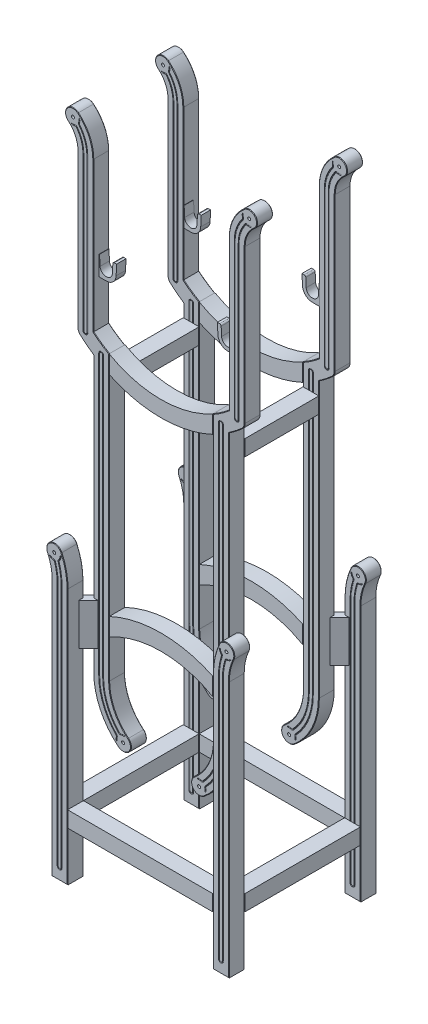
SolidWorks part; units mm, degrees
ref_plane "Спереди" through (0, 0, 0) normal (0, 0, 1) x (1, 0, 0)
ref_plane "Сверху" through (0, 0, 0) normal (0, 1, 0) x (1, 0, 0)
ref_plane "Справа" through (0, 0, 0) normal (1, 0, 0) x (0, 0, -1)
sketch "Эскиз1" plane through (0, 0, 0) normal (0, 0, 1) x (1, 0, 0)
  line L0 (0, 1637.8795) -> (0, -58.0096) construction
  line L1 (-137, 1254.605) -> (-137, 952.3834)
  line L2 (-169, 1254.605) -> (-169, 945.0706)
  line L3 (-223, 1254.605) -> (-137, 1254.605) construction
  line L4 (-223, 1324.28) -> (-137, 1324.28) construction
  line L5 (-318.8332, 902.64) -> (342.8075, 902.64) construction
  line L6 (-137, 912.4153) -> (-137, 357)
  line L7 (-105, 930.2397) -> (-105, 357)
  line L8 (-60.855, 312.7131) -> (-60.855, 178.9161) construction
  line L9 (137, 1254.605) -> (137, 952.3834)
  line L10 (169, 1254.605) -> (169, 945.0706)
  line L11 (137, 912.4153) -> (137, 357)
  line L12 (105, 930.2397) -> (105, 357)
  arc A0 (-137, 1254.605) -> (-167.7963, 1320.5486) centre (-223, 1254.605) ccw
  arc A1 (-169, 1254.605) -> (-188.3372, 1296.0114) centre (-223, 1254.605) ccw
  arc A2 (-167.7963, 1320.5486) -> (-188.3372, 1296.0114) centre (-178.0668, 1308.28) ccw
  circle A3 centre (-223, 1254.605) radius 86 construction
  circle A4 centre (-223, 1254.605) radius 54 construction
  arc A5 (-137, 952.3834) -> (-105, 930.2397) centre (0, 1116.17) ccw
  arc A6 (-163.6653, 933.1436) -> (-137, 912.4153) centre (0, 1116.17) ccw
  arc A7 (-157.5311, 927.838) -> (0, 870.64) centre (0, 1116.17) ccw construction
  arc A8 (-137, 952.3834) -> (0, 902.64) centre (0, 1116.17) ccw construction
  arc A9 (-163.6653, 933.1436) -> (-169, 945.0706) centre (-153, 945.0706) cw
  arc A10 (-105, 357) -> (-66.6924, 275.9005) centre (0, 357) ccw
  arc A11 (-137, 357) -> (-87.0176, 251.1845) centre (0, 357) ccw
  circle A12 centre (0, 357) radius 137 construction
  circle A13 centre (0, 357) radius 105 construction
  arc A14 (-87.0176, 251.1845) -> (-66.6924, 275.9005) centre (-76.855, 263.5425) ccw
  arc A15 (137, 1254.605) -> (167.7963, 1320.5486) centre (223, 1254.605) cw
  arc A16 (167.7963, 1320.5486) -> (188.3372, 1296.0114) centre (178.0668, 1308.28) cw
  arc A17 (169, 1254.605) -> (188.3372, 1296.0114) centre (223, 1254.605) cw
  arc A18 (163.6653, 933.1436) -> (169, 945.0706) centre (153, 945.0706) ccw
  arc A19 (137, 952.3834) -> (105, 930.2397) centre (0, 1116.17) cw
  arc A20 (163.6653, 933.1436) -> (137, 912.4153) centre (0, 1116.17) cw
  arc A21 (105, 357) -> (66.6924, 275.9005) centre (0, 357) cw
  arc A22 (137, 357) -> (87.0176, 251.1845) centre (0, 357) cw
  arc A23 (87.0176, 251.1845) -> (66.6924, 275.9005) centre (76.855, 263.5425) cw
  dimension "D3" = 172
  dimension "D6" = 32
  dimension "D9" = 427.06
  dimension "D13" = 16
  dimension "D14" = 210
  dimension "D1" = 32
  dimension "D2" = 169
  dimension "D5" = 69.675
  dimension "D7" = 1324.28
  dimension "D8" = 421.64
  dimension "D11" = 32
  dimension "D12" = 137
  dimension "D15" = 357
  dimension "D17" = 60.855
  dimension "D4" = 32
  dimension "D10" = 32
  dimension "D16" = 32
extrude "Бобышка-Вытянуть1" add sketch "Эскиз1" along normal blind 32
sketch "Эскиз2" plane through (0, 0, 0) normal (0, 0, 1) x (1, 0, 0)
  line L0 (0, 1637.8795) -> (0, -58.0096) construction
  line L1 (-105, 930.2397) -> (-105, 357) construction
  line L2 (-105, 930.2397) -> (-105, 894.2241)
  line L3 (105, 930.2397) -> (105, 894.2241)
  line L4 (-232.7595, 494) -> (202.7807, 494) construction
  line L5 (-232.7595, 870.64) -> (202.7807, 870.64) construction
  line L6 (-105, 470.4159) -> (-105, 434.4003)
  line L7 (105, 470.4159) -> (105, 434.4003)
  line L8 (-53.704, 417) -> (42.7851, 417) construction
  arc A0 (-137, 952.3834) -> (-105, 930.2397) centre (0, 1116.17) ccw construction
  arc A1 (-105, 930.2397) -> (105, 930.2397) centre (0, 1116.17) ccw
  arc A2 (-163.6653, 933.1436) -> (-137, 912.4153) centre (0, 1116.17) ccw construction
  arc A3 (-105, 894.2241) -> (105, 894.2241) centre (0, 1116.17) ccw
  arc A4 (105, 470.4159) -> (-105, 470.4159) centre (0, 248.47) ccw
  arc A5 (105, 434.4003) -> (-105, 434.4003) centre (0, 248.47) ccw
  circle A6 centre (0, 248.47) radius 245.53 construction
  circle A7 centre (0, 248.47) radius 213.53 construction
  circle A8 centre (0, 357) radius 60 construction
  arc A9 (-105, 357) -> (-66.6924, 275.9005) centre (0, 357) ccw construction
  dimension "D1" = 213.53
  dimension "D4" = 120
  dimension "D2" = 77
  dimension "D3" = 32
extrude "Бобышка-Вытянуть2" add sketch "Эскиз2" along normal blind 32 separate body
ref_plane "Плоскость1" through (0, 0, -150) normal (0, 0, 1) x (1, 0, 0)
sketch "Эскиз3" plane through (0, 0, -150) normal (0, 0, 1) x (1, 0, 0)
  line L0 (-169, 1254.605) -> (-169, 945.0706) construction
  line L1 (-137, 1254.605) -> (-137, 952.3834) construction
  line L2 (-105, 930.2397) -> (-105, 357) construction
  line L3 (-137, 912.4153) -> (-137, 357) construction
  line L4 (105, 930.2397) -> (105, 357) construction
  line L5 (137, 912.4153) -> (137, 357) construction
  line L6 (169, 1254.605) -> (169, 945.0706) construction
  line L7 (137, 1254.605) -> (137, 952.3834) construction
  line L8 (-169, 1254.605) -> (-169, 945.0706)
  line L9 (-137, 1254.605) -> (-137, 952.3834)
  line L10 (-105, 930.2397) -> (-105, 357)
  line L11 (-137, 912.4153) -> (-137, 357)
  line L12 (105, 930.2397) -> (105, 357)
  line L13 (137, 912.4153) -> (137, 357)
  line L14 (169, 1254.605) -> (169, 945.0706)
  line L15 (137, 1254.605) -> (137, 952.3834)
  arc A0 (-167.7963, 1320.5486) -> (-188.3372, 1296.0114) centre (-178.0668, 1308.28) ccw construction
  arc A1 (-169, 1254.605) -> (-188.3372, 1296.0114) centre (-223, 1254.605) ccw construction
  arc A2 (-137, 1254.605) -> (-167.7963, 1320.5486) centre (-223, 1254.605) ccw construction
  arc A3 (-163.6653, 933.1436) -> (-137, 912.4153) centre (0, 1116.17) ccw construction
  arc A4 (-169, 945.0706) -> (-163.6653, 933.1436) centre (-153, 945.0706) ccw construction
  arc A5 (-137, 952.3834) -> (-105, 930.2397) centre (0, 1116.17) ccw construction
  arc A6 (-137, 357) -> (-87.0176, 251.1845) centre (0, 357) ccw construction
  arc A7 (-105, 357) -> (-66.6924, 275.9005) centre (0, 357) ccw construction
  arc A8 (-87.0176, 251.1845) -> (-66.6924, 275.9005) centre (-76.855, 263.5425) ccw construction
  arc A9 (66.6924, 275.9005) -> (87.0176, 251.1845) centre (76.855, 263.5425) ccw construction
  arc A10 (66.6924, 275.9005) -> (105, 357) centre (0, 357) ccw construction
  arc A11 (87.0176, 251.1845) -> (137, 357) centre (0, 357) ccw construction
  arc A12 (105, 930.2397) -> (137, 952.3834) centre (0, 1116.17) ccw construction
  arc A13 (137, 912.4153) -> (163.6653, 933.1436) centre (0, 1116.17) ccw construction
  arc A14 (163.6653, 933.1436) -> (169, 945.0706) centre (153, 945.0706) ccw construction
  arc A15 (167.7963, 1320.5486) -> (137, 1254.605) centre (223, 1254.605) ccw construction
  arc A16 (188.3372, 1296.0114) -> (169, 1254.605) centre (223, 1254.605) ccw construction
  arc A17 (188.3372, 1296.0114) -> (167.7963, 1320.5486) centre (178.0668, 1308.28) ccw construction
  arc A18 (-167.7963, 1320.5486) -> (-188.3372, 1296.0114) centre (-178.0668, 1308.28) ccw
  arc A19 (-169, 1254.605) -> (-188.3372, 1296.0114) centre (-223, 1254.605) ccw
  arc A20 (-137, 1254.605) -> (-167.7963, 1320.5486) centre (-223, 1254.605) ccw
  arc A21 (-163.6653, 933.1436) -> (-137, 912.4153) centre (0, 1116.17) ccw
  arc A22 (-169, 945.0706) -> (-163.6653, 933.1436) centre (-153, 945.0706) ccw
  arc A23 (-137, 952.3834) -> (-105, 930.2397) centre (0, 1116.17) ccw
  arc A24 (-137, 357) -> (-87.0176, 251.1845) centre (0, 357) ccw
  arc A25 (-105, 357) -> (-66.6924, 275.9005) centre (0, 357) ccw
  arc A26 (-87.0176, 251.1845) -> (-66.6924, 275.9005) centre (-76.855, 263.5425) ccw
  arc A27 (66.6924, 275.9005) -> (87.0176, 251.1845) centre (76.855, 263.5425) ccw
  arc A28 (66.6924, 275.9005) -> (105, 357) centre (0, 357) ccw
  arc A29 (87.0176, 251.1845) -> (137, 357) centre (0, 357) ccw
  arc A30 (105, 930.2397) -> (137, 952.3834) centre (0, 1116.17) ccw
  arc A31 (137, 912.4153) -> (163.6653, 933.1436) centre (0, 1116.17) ccw
  arc A32 (163.6653, 933.1436) -> (169, 945.0706) centre (153, 945.0706) ccw
  arc A33 (167.7963, 1320.5486) -> (137, 1254.605) centre (223, 1254.605) ccw
  arc A34 (188.3372, 1296.0114) -> (169, 1254.605) centre (223, 1254.605) ccw
  arc A35 (188.3372, 1296.0114) -> (167.7963, 1320.5486) centre (178.0668, 1308.28) ccw
extrude "Бобышка-Вытянуть3" add sketch "Эскиз3" against normal blind 32 separate body
sketch "Эскиз4" plane through (0, 0, -150) normal (0, 0, 1) x (1, 0, 0)
  line L0 (-105, 930.2397) -> (-105, 894.2241) construction
  line L1 (105, 930.2397) -> (105, 894.2241) construction
  line L2 (-105, 470.4159) -> (-105, 434.4003) construction
  line L3 (105, 470.4159) -> (105, 434.4003) construction
  line L4 (-105, 930.2397) -> (-105, 894.2241)
  line L5 (105, 930.2397) -> (105, 894.2241)
  line L6 (-105, 470.4159) -> (-105, 434.4003)
  line L7 (105, 470.4159) -> (105, 434.4003)
  arc A0 (-105, 930.2397) -> (105, 930.2397) centre (0, 1116.17) ccw construction
  arc A1 (-105, 894.2241) -> (105, 894.2241) centre (0, 1116.17) ccw construction
  arc A2 (105, 434.4003) -> (-105, 434.4003) centre (0, 248.47) ccw construction
  arc A3 (105, 470.4159) -> (-105, 470.4159) centre (0, 248.47) ccw construction
  arc A4 (-105, 930.2397) -> (105, 930.2397) centre (0, 1116.17) ccw
  arc A5 (-105, 894.2241) -> (105, 894.2241) centre (0, 1116.17) ccw
  arc A6 (105, 434.4003) -> (-105, 434.4003) centre (0, 248.47) ccw
  arc A7 (105, 470.4159) -> (-105, 470.4159) centre (0, 248.47) ccw
extrude "Бобышка-Вытянуть4" add sketch "Эскиз4" against normal blind 32 separate body
sketch "Эскиз5" plane through (137, 0, 0) normal (1, 0, 0) x (0, 0, -1)
  line L0 (0, 886.555) -> (150, 886.555)
  line L1 (0, 357) -> (0, 912.4153) construction
  line L2 (150, 357) -> (150, 912.4153) construction
  line L3 (0, 854.555) -> (150, 854.555)
  line L5 (0, 1324.28) -> (-32, 1324.28) construction
  line L6 (0, 886.555) -> (0, 854.555)
  line L7 (150, 886.555) -> (150, 854.555)
  dimension "D1" = 32
  dimension "D2" = 437.725
extrude "Бобышка-Вытянуть5" add sketch "Эскиз5" against normal blind 32 separate body
sketch "Эскиз6" plane through (-137, 0, 0) normal (-1, 0, 0) x (0, 0, 1)
  line L0 (-150, 886.555) -> (0, 886.555) construction
  line L1 (0, 854.555) -> (-150, 854.555) construction
  line L2 (-150, 886.555) -> (0, 886.555)
  line L3 (0, 854.555) -> (-150, 854.555)
  line L4 (0, 912.4153) -> (0, 357)
  line L5 (0, 357) -> (32, 357)
  line L6 (32, 357) -> (32, 912.4153)
  line L7 (32, 912.4153) -> (0, 912.4153)
  line L8 (0, 912.4153) -> (0, 357)
  line L9 (0, 357) -> (32, 357)
  line L10 (32, 357) -> (32, 912.4153)
  line L11 (32, 912.4153) -> (0, 912.4153)
  line L12 (-150, 886.555) -> (-150, 854.555)
  line L13 (0, 886.555) -> (0, 854.555)
  dimension "D1" = 0
extrude "Бобышка-Вытянуть6" add sketch "Эскиз6" against normal blind 32 separate body contours L3 L12 L2 L13
chamfer "Фаска1" distance 1 angle 45 13 edges at (-121.5055, 940.5811, 32) (-137, 1103.4942, 32) (-145.0785, 1290.9951, 32) (-105, 643.6199, 32) (-190.3354, 1318.5505, 32) (-94.9413, 312.1541, 32) (-174.0726, 1277.4546, 32) (-64.497, 253.3798, 32) (-169, 1099.8378, 32) (-123.8758, 298.4868, 32) (-167.6056, 938.5377, 32) (-137, 634.7076, 32) (-150.6895, 922.3204, 32)
chamfer "Фаска2" distance 1 angle 45 13 edges at (137, 1103.4942, 32) (145.0785, 1290.9951, 32) (190.3354, 1318.5505, 32) (174.0726, 1277.4546, 32) (169, 1099.8378, 32) (167.6056, 938.5377, 32) (150.6895, 922.3204, 32) (121.5055, 940.5811, 32) (105, 643.6199, 32) (94.9413, 312.1541, 32) (64.497, 253.3798, 32) (137, 634.7076, 32) (123.8758, 298.4868, 32)
chamfer "Фаска3" distance 1 angle 45 4 edges at (105, 912.2319, 32) (-105, 912.2319, 32) (105, 912.2319, 0) (-105, 912.2319, 0)
chamfer "Фаска4" distance 1 angle 45 2 edges at (105, 452.4081, 32) (-105, 452.4081, 32)
chamfer "Фаска5" distance 1 angle 45 13 edges at (137, 1103.4942, 0) (145.0785, 1290.9951, 0) (190.3354, 1318.5505, 0) (174.0726, 1277.4546, 0) (169, 1099.8378, 0) (167.6056, 938.5377, 0) (150.6895, 922.3204, 0) (121.5055, 940.5811, 0) (137, 634.7076, 0) (123.8758, 298.4868, 0) (105, 643.6199, 0) (64.497, 253.3798, 0) (94.9413, 312.1541, 0)
chamfer "Фаска6" distance 1 angle 45 13 edges at (-137, 1103.4942, 0) (-145.0785, 1290.9951, 0) (-190.3354, 1318.5505, 0) (-174.0726, 1277.4546, 0) (-169, 1099.8378, 0) (-167.6056, 938.5377, 0) (-150.6895, 922.3204, 0) (-121.5055, 940.5811, 0) (-137, 634.7076, 0) (-123.8758, 298.4868, 0) (-64.497, 253.3798, 0) (-105, 643.6199, 0) (-94.9413, 312.1541, 0)
chamfer "Фаска7" distance 1 angle 45 2 edges at (-105, 452.4081, 0) (105, 452.4081, 0)
chamfer "Фаска8" distance 1 angle 45 13 edges at (-137, 1103.4942, -150) (-145.0785, 1290.9951, -150) (-190.3354, 1318.5505, -150) (-174.0726, 1277.4546, -150) (-169, 1099.8378, -150) (-167.6056, 938.5377, -150) (-150.6895, 922.3204, -150) (-137, 634.7076, -150) (-123.8758, 298.4868, -150) (-64.497, 253.3798, -150) (-94.9413, 312.1541, -150) (-121.5055, 940.5811, -150) (-105, 643.6199, -150)
chamfer "Фаска9" distance 1 angle 45 13 edges at (150.6895, 922.3204, -150) (167.6056, 938.5377, -150) (137, 634.7076, -150) (169, 1099.8378, -150) (123.8758, 298.4868, -150) (174.0726, 1277.4546, -150) (64.497, 253.3798, -150) (190.3354, 1318.5505, -150) (94.9413, 312.1541, -150) (145.0785, 1290.9951, -150) (105, 643.6199, -150) (121.5055, 940.5811, -150) (137, 1103.4942, -150)
chamfer "Фаска10" distance 1 angle 45 2 edges at (105, 452.4081, -150) (-105, 452.4081, -150)
chamfer "Фаска11" distance 1 angle 45 13 edges at (105, 643.6199, -182) (94.9413, 312.1541, -182) (64.497, 253.3798, -182) (123.8758, 298.4868, -182) (137, 634.7076, -182) (150.6895, 922.3204, -182) (167.6056, 938.5377, -182) (169, 1099.8378, -182) (174.0726, 1277.4546, -182) (190.3354, 1318.5505, -182) (145.0785, 1290.9951, -182) (137, 1103.4942, -182) (121.5055, 940.5811, -182)
chamfer "Фаска12" distance 1 angle 45 13 edges at (-137, 1103.4942, -182) (-145.0785, 1290.9951, -182) (-190.3354, 1318.5505, -182) (-174.0726, 1277.4546, -182) (-169, 1099.8378, -182) (-167.6056, 938.5377, -182) (-150.6895, 922.3204, -182) (-137, 634.7076, -182) (-123.8758, 298.4868, -182) (-64.497, 253.3798, -182) (-94.9413, 312.1541, -182) (-121.5055, 940.5811, -182) (-105, 643.6199, -182)
chamfer "Фаска13" distance 1 angle 45 4 edges at (-105, 912.2319, -182) (105, 912.2319, -182) (-105, 912.2319, -150) (105, 912.2319, -150)
chamfer "Фаска14" distance 1 angle 45 2 edges at (-105, 452.4081, -182) (105, 452.4081, -182)
chamfer "Фаска15" distance 1 angle 45 4 edges at (105, 870.555, 0) (105, 870.555, -150) (137, 870.555, -150) (137, 870.555, 0)
chamfer "Фаска16" distance 1 angle 45 4 edges at (-105, 870.555, 0) (-105, 870.555, -150) (-137, 870.555, 0) (-137, 870.555, -150)
ref_plane "Плоскость2" through (0, 0, 1) normal (0, 0, 1) x (1, 0, 0)
sketch "Эскиз7" plane through (0, 0, 1) normal (0, 0, 1) x (1, 0, 0)
  line L0 (0, 1411.9456) -> (0, 0) construction
  line L1 (122.85, 1062.87) -> (0, 1062.87) construction
  line L2 (0, 1062.87) -> (-122.85, 1062.87) construction
  line L3 (-137, 1042.87) -> (-122.85, 1042.87)
  line L4 (-137, 1254.605) -> (-137, 952.3834) construction
  line L5 (-109.4965, 1080.0165) -> (-110.3649, 1062.2594)
  line L6 (-122.85, 1062.87) -> (-122.85, 1042.87) construction
  line L7 (-101.8479, 1082.87) -> (-102.8739, 1061.893)
  line L8 (-106.5, 1082.87) -> (-101.8479, 1082.87)
  line L9 (-136.3431, 1082.87) -> (-135.3351, 1062.2594)
  line L10 (-136.3431, 1082.87) -> (-137, 1082.87)
  line L11 (-137, 1082.87) -> (-137, 1042.87)
  line L12 (136.3431, 1082.87) -> (137, 1082.87)
  line L13 (136.3431, 1082.87) -> (135.3351, 1062.2594)
  line L14 (137, 1082.87) -> (137, 1042.87)
  line L15 (137, 1042.87) -> (122.85, 1042.87)
  line L16 (109.4965, 1080.0165) -> (110.3649, 1062.2594)
  line L17 (101.8479, 1082.87) -> (102.8739, 1061.893)
  line L18 (106.5, 1082.87) -> (101.8479, 1082.87)
  arc A0 (-135.3351, 1062.2594) -> (-110.3649, 1062.2594) centre (-122.85, 1062.87) ccw
  arc A1 (110.3649, 1062.2594) -> (135.3351, 1062.2594) centre (122.85, 1062.87) ccw
  arc A2 (-122.85, 1042.87) -> (-102.8739, 1061.893) centre (-122.85, 1062.87) ccw
  arc A3 (-106.5, 1082.87) -> (-109.4965, 1080.0165) centre (-106.5, 1079.87) ccw
  arc A4 (122.85, 1042.87) -> (102.8739, 1061.893) centre (122.85, 1062.87) cw
  arc A5 (106.5, 1082.87) -> (109.4965, 1080.0165) centre (106.5, 1079.87) cw
  point P20 (-109.3569, 1082.87)
  dimension "D1" = 25
  dimension "D7" = 3
  dimension "D2" = 1062.87
  dimension "D3" = 245.7
  dimension "D4" = 20
  dimension "D5" = 2.8
  dimension "D6" = 20
extrude "Бобышка-Вытянуть7" add sketch "Эскиз7" along normal blind 19 separate body
ref_plane "Плоскость3" through (0, 0, -151) normal (0, 0, 1) x (1, 0, 0)
sketch "Эскиз8" plane through (0, 0, -151) normal (0, 0, 1) x (1, 0, 0)
  line L0 (-135.3351, 1062.2594) -> (-136.3431, 1082.87) construction
  line L1 (-109.4965, 1080.0165) -> (-110.3649, 1062.2594) construction
  line L2 (-101.8479, 1082.87) -> (-106.5, 1082.87) construction
  line L3 (-102.8739, 1061.893) -> (-101.8479, 1082.87) construction
  line L4 (-137, 1042.87) -> (-122.85, 1042.87) construction
  line L5 (-137, 1082.87) -> (-137, 1042.87) construction
  line L6 (-136.3431, 1082.87) -> (-137, 1082.87) construction
  line L7 (110.3649, 1062.2594) -> (109.4965, 1080.0165) construction
  line L8 (106.5, 1082.87) -> (101.8479, 1082.87) construction
  line L9 (101.8479, 1082.87) -> (102.8739, 1061.893) construction
  line L10 (122.85, 1042.87) -> (137, 1042.87) construction
  line L11 (136.3431, 1082.87) -> (135.3351, 1062.2594) construction
  line L12 (137, 1042.87) -> (137, 1082.87) construction
  line L13 (137, 1082.87) -> (136.3431, 1082.87) construction
  line L14 (-135.3351, 1062.2594) -> (-136.3431, 1082.87)
  line L15 (-109.4965, 1080.0165) -> (-110.3649, 1062.2594)
  line L16 (-101.8479, 1082.87) -> (-106.5, 1082.87)
  line L17 (-102.8739, 1061.893) -> (-101.8479, 1082.87)
  line L18 (-137, 1042.87) -> (-122.85, 1042.87)
  line L19 (-137, 1082.87) -> (-137, 1042.87)
  line L20 (-136.3431, 1082.87) -> (-137, 1082.87)
  line L21 (110.3649, 1062.2594) -> (109.4965, 1080.0165)
  line L22 (106.5, 1082.87) -> (101.8479, 1082.87)
  line L23 (101.8479, 1082.87) -> (102.8739, 1061.893)
  line L24 (122.85, 1042.87) -> (137, 1042.87)
  line L25 (136.3431, 1082.87) -> (135.3351, 1062.2594)
  line L26 (137, 1042.87) -> (137, 1082.87)
  line L27 (137, 1082.87) -> (136.3431, 1082.87)
  arc A0 (-135.3351, 1062.2594) -> (-110.3649, 1062.2594) centre (-122.85, 1062.87) ccw construction
  arc A1 (-106.5, 1082.87) -> (-109.4965, 1080.0165) centre (-106.5, 1079.87) ccw construction
  arc A2 (-122.85, 1042.87) -> (-102.8739, 1061.893) centre (-122.85, 1062.87) ccw construction
  arc A3 (110.3649, 1062.2594) -> (135.3351, 1062.2594) centre (122.85, 1062.87) ccw construction
  arc A4 (109.4965, 1080.0165) -> (106.5, 1082.87) centre (106.5, 1079.87) ccw construction
  arc A5 (102.8739, 1061.893) -> (122.85, 1042.87) centre (122.85, 1062.87) ccw construction
  arc A6 (-135.3351, 1062.2594) -> (-110.3649, 1062.2594) centre (-122.85, 1062.87) ccw
  arc A7 (-106.5, 1082.87) -> (-109.4965, 1080.0165) centre (-106.5, 1079.87) ccw
  arc A8 (-122.85, 1042.87) -> (-102.8739, 1061.893) centre (-122.85, 1062.87) ccw
  arc A9 (110.3649, 1062.2594) -> (135.3351, 1062.2594) centre (122.85, 1062.87) ccw
  arc A10 (109.4965, 1080.0165) -> (106.5, 1082.87) centre (106.5, 1079.87) ccw
  arc A11 (102.8739, 1061.893) -> (122.85, 1042.87) centre (122.85, 1062.87) ccw
extrude "Бобышка-Вытянуть8" add sketch "Эскиз8" against normal blind 19 separate body
ref_plane "Плоскость4" through (0, 0, 42) normal (0, 0, 1) x (1, 0, 0)
sketch "Эскиз10" plane through (0, 0, 42) normal (0, 0, 1) x (1, 0, 0)
  line L0 (-179, 0) -> (-147, 0)
  line L1 (-147, 0) -> (-147, 518.3739)
  line L2 (0, 1637.8795) -> (0, -58.0096) construction
  line L3 (-179, 0) -> (-179, 518.3739)
  line L4 (-567.1911, 585) -> (-188.5359, 585) construction
  line L5 (-190, 641.0969) -> (-190, 503.8539) construction
  line L6 (0, 1116.17) -> (0, -58.0096) construction
  line L7 (179, 0) -> (147, 0)
  line L8 (147, 0) -> (147, 518.3739)
  line L9 (179, 0) -> (179, 518.3739)
  arc A0 (-179, 518.3739) -> (-188.5574, 562.3605) centre (-285, 518.3739) ccw
  arc A1 (-147, 518.3739) -> (-159.4426, 575.6395) centre (-285, 518.3739) ccw
  arc A2 (-159.4426, 575.6395) -> (-188.5574, 562.3605) centre (-174, 569) ccw
  circle A3 centre (-285, 518.3739) radius 106 construction
  circle A4 centre (-285, 518.3739) radius 138 construction
  arc A5 (147, 518.3739) -> (159.4426, 575.6395) centre (285, 518.3739) cw
  arc A6 (179, 518.3739) -> (188.5574, 562.3605) centre (285, 518.3739) cw
  arc A7 (159.4426, 575.6395) -> (188.5574, 562.3605) centre (174, 569) cw
  dimension "D3" = 212
  dimension "D1" = 147
  dimension "D2" = 32
  dimension "D5" = 585
  dimension "D6" = 190
  dimension "D4" = 32
extrude "Бобышка-Вытянуть9" add sketch "Эскиз10" along normal blind 32 separate body
sketch "Эскиз11" plane through (0, 0, 42) normal (0, 0, 1) x (1, 0, 0)
  line L0 (-147, 132) -> (147, 132)
  line L1 (-147, 0) -> (-147, 518.3739) construction
  line L2 (147, 518.3739) -> (147, 0) construction
  line L3 (147, 132) -> (147, 100)
  line L4 (147, 100) -> (-147, 100)
  line L5 (-147, 100) -> (-147, 132)
  line L6 (-179, 0) -> (-147, 0) construction
  dimension "D1" = 32
  dimension "D2" = 100
extrude "Бобышка-Вытянуть10" add sketch "Эскиз11" along normal blind 32 separate body
ref_plane "Плоскость5" through (0, 0, -192) normal (0, 0, 1) x (1, 0, 0)
sketch "Эскиз12" plane through (0, 0, -192) normal (0, 0, 1) x (1, 0, 0)
  line L0 (-179, 0) -> (-179, 518.3739) construction
  line L1 (-147, 0) -> (-147, 518.3739) construction
  line L2 (-179, 0) -> (-147, 0) construction
  line L3 (179, 0) -> (147, 0) construction
  line L4 (147, 0) -> (147, 518.3739) construction
  line L5 (179, 0) -> (179, 518.3739) construction
  line L6 (-179, 0) -> (-179, 518.3739)
  line L7 (-147, 0) -> (-147, 518.3739)
  line L8 (-179, 0) -> (-147, 0)
  line L9 (179, 0) -> (147, 0)
  line L10 (147, 0) -> (147, 518.3739)
  line L11 (179, 0) -> (179, 518.3739)
  arc A0 (-159.4426, 575.6395) -> (-188.5574, 562.3605) centre (-174, 569) ccw construction
  arc A1 (-179, 518.3739) -> (-188.5574, 562.3605) centre (-285, 518.3739) ccw construction
  arc A2 (-147, 518.3739) -> (-159.4426, 575.6395) centre (-285, 518.3739) ccw construction
  arc A3 (159.4426, 575.6395) -> (147, 518.3739) centre (285, 518.3739) ccw construction
  arc A4 (188.5574, 562.3605) -> (159.4426, 575.6395) centre (174, 569) ccw construction
  arc A5 (188.5574, 562.3605) -> (179, 518.3739) centre (285, 518.3739) ccw construction
  arc A6 (-159.4426, 575.6395) -> (-188.5574, 562.3605) centre (-174, 569) ccw
  arc A7 (-179, 518.3739) -> (-188.5574, 562.3605) centre (-285, 518.3739) ccw
  arc A8 (-147, 518.3739) -> (-159.4426, 575.6395) centre (-285, 518.3739) ccw
  arc A9 (159.4426, 575.6395) -> (147, 518.3739) centre (285, 518.3739) ccw
  arc A10 (188.5574, 562.3605) -> (159.4426, 575.6395) centre (174, 569) ccw
  arc A11 (188.5574, 562.3605) -> (179, 518.3739) centre (285, 518.3739) ccw
extrude "Бобышка-Вытянуть11" add sketch "Эскиз12" against normal blind 32 separate body
sketch "Эскиз13" plane through (0, 0, -192) normal (0, 0, 1) x (1, 0, 0)
  line L0 (147, 132) -> (-147, 132) construction
  line L1 (-147, 100) -> (147, 100) construction
  line L2 (147, 132) -> (-147, 132)
  line L3 (-147, 100) -> (147, 100)
  line L4 (147, 132) -> (147, 100)
  line L5 (-147, 132) -> (-147, 100)
extrude "Бобышка-Вытянуть12" add sketch "Эскиз13" against normal blind 32 separate body
sketch "Эскиз14" plane through (179, 0, 0) normal (1, 0, 0) x (0, 0, -1)
  line L0 (-42, 0) -> (-42, 518.3739) construction
  line L1 (-42, 132) -> (192, 132)
  line L2 (-42, 132) -> (-42, 100)
  line L3 (-42, 100) -> (192, 100)
  line L4 (192, 132) -> (192, 100)
  line L5 (192, 0) -> (192, 518.3739) construction
  line L6 (-74, 0) -> (-42, 0) construction
  dimension "D1" = 32
  dimension "D2" = 100
extrude "Бобышка-Вытянуть13" add sketch "Эскиз14" against normal blind 32 separate body
sketch "Эскиз15" plane through (-179, 0, 0) normal (-1, 0, 0) x (0, 0, 1)
  line L0 (-192, 132) -> (42, 132) construction
  line L1 (42, 100) -> (-192, 100) construction
  line L2 (-192, 132) -> (42, 132)
  line L3 (42, 100) -> (-192, 100)
  line L4 (42, 518.3739) -> (42, 0)
  line L5 (42, 0) -> (74, 0)
  line L6 (74, 0) -> (74, 518.3739)
  line L7 (74, 518.3739) -> (42, 518.3739)
  line L8 (42, 518.3739) -> (42, 0)
  line L9 (42, 0) -> (74, 0)
  line L10 (74, 0) -> (74, 518.3739)
  line L11 (74, 518.3739) -> (42, 518.3739)
  line L12 (-192, 132) -> (-192, 100)
  line L13 (42, 132) -> (42, 100)
  dimension "D1" = 0
extrude "Бобышка-Вытянуть14" add sketch "Эскиз15" against normal blind 32 separate body contours L2 L12 L3 M5
chamfer "Фаска17" distance 1 angle 45 6 edges at (163, 0, 74) (147, 259.187, 74) (150.1465, 547.6748, 74) (180.6395, 583.5574, 74) (181.4169, 540.8804, 74) (179, 259.187, 74)
chamfer "Фаска18" distance 1 angle 45 6 edges at (-181.4169, 540.8804, 74) (-180.6395, 583.5574, 74) (-150.1465, 547.6748, 74) (-147, 259.187, 74) (-163, 0, 74) (-179, 259.187, 74)
chamfer "Фаска19" distance 1 angle 45 6 edges at (181.4169, 540.8804, -224) (180.6395, 583.5574, -224) (150.1465, 547.6748, -224) (147, 259.187, -224) (163, 0, -224) (179, 259.187, -224)
chamfer "Фаска20" distance 1 angle 45 6 edges at (-180.6395, 583.5574, -224) (-181.4169, 540.8804, -224) (-179, 259.187, -224) (-163, 0, -224) (-147, 259.187, -224) (-150.1465, 547.6748, -224)
chamfer "Фаска21" distance 1 angle 45 6 edges at (181.4169, 540.8804, 42) (180.6395, 583.5574, 42) (150.1465, 547.6748, 42) (147, 259.187, 42) (163, 0, 42) (179, 259.187, 42)
chamfer "Фаска22" distance 1 angle 45 6 edges at (-163, 0, 42) (-147, 259.187, 42) (-150.1465, 547.6748, 42) (-180.6395, 583.5574, 42) (-181.4169, 540.8804, 42) (-179, 259.187, 42)
chamfer "Фаска23" distance 1 angle 45 6 edges at (163, 0, -192) (147, 259.187, -192) (150.1465, 547.6748, -192) (180.6395, 583.5574, -192) (181.4169, 540.8804, -192) (179, 259.187, -192)
chamfer "Фаска24" distance 1 angle 45 6 edges at (-147, 259.187, -192) (-163, 0, -192) (-179, 259.187, -192) (-181.4169, 540.8804, -192) (-180.6395, 583.5574, -192) (-150.1465, 547.6748, -192)
chamfer "Фаска25" distance 1 angle 45 4 edges at (147, 116, 42) (-147, 116, 42) (-147, 116, 74) (147, 116, 74)
chamfer "Фаска26" distance 1 angle 45 4 edges at (147, 116, -192) (-147, 116, -192) (-147, 116, -224) (147, 116, -224)
chamfer "Фаска27" distance 1 angle 45 4 edges at (-147, 116, -192) (-147, 116, 42) (-179, 116, -192) (-179, 116, 42)
chamfer "Фаска28" distance 1 angle 45 4 edges at (147, 116, -192) (147, 116, 42) (179, 116, -192) (179, 116, 42)
sketch "Эскиз17" plane through (0, 0, 0) normal (0, 0, 1) x (1, 0, 0)
  line L0 (147, 518.3739) -> (147, 0) construction
  line L1 (147, 518.3739) -> (147, 0)
  arc A0 (105, 434.4003) -> (-105, 434.4003) centre (0, 248.47) ccw construction
  arc A1 (147, 403.3443) -> (-105, 434.4003) centre (0, 248.47) ccw
ref_plane "Плоскость6" through (0, 403.3443, 0) normal (0, 1, 0) x (-1, 0, 0)
ref_plane "Плоскость7" through (0, 487.3443, 0) normal (0, 1, 0) x (-1, 0, 0)
sketch "Эскиз16" plane through (0, 487.3443, 0) normal (0, 1, 0) x (-1, 0, 0)
  line L0 (-147, 73) -> (-147, 43) construction
  line L1 (-147, 51.3762) -> (-147, 43)
  line L2 (-160.3525, 42) -> (-148, 42) construction
  line L3 (-156.3762, 42) -> (-148, 42)
  line L4 (-147, 43) -> (-148, 42)
  line L5 (-137, 31) -> (-137, 1) construction
  line L6 (-137, 31) -> (-137, 22.6238)
  line L7 (-86.3825, 32) -> (-136, 32) construction
  line L8 (-127.6238, 32) -> (-136, 32)
  line L9 (-136, 32) -> (-137, 31)
  line L10 (-136.5, 31.5) -> (-147.5, 42.5) construction
  line L11 (-147, 51.3762) -> (-127.6238, 32)
  line L12 (-156.3762, 42) -> (-137, 22.6238)
  line L13 (0, 0) -> (0, -150) construction
  line L14 (104, -150) -> (-104, -150) construction
  line L15 (0, -75) -> (-232.1098, -75) construction
  line L16 (137, 31) -> (137, 22.6238)
  line L17 (127.6238, 32) -> (136, 32)
  line L18 (136, 32) -> (137, 31)
  line L19 (147, 51.3762) -> (127.6238, 32)
  line L20 (147, 43) -> (148, 42)
  line L21 (147, 51.3762) -> (147, 43)
  line L22 (156.3762, 42) -> (148, 42)
  line L23 (156.3762, 42) -> (137, 22.6238)
  line L24 (147, -201.3762) -> (147, -193)
  line L25 (147, -193) -> (148, -192)
  line L26 (156.3762, -192) -> (148, -192)
  line L27 (147, -201.3762) -> (127.6238, -182)
  line L28 (127.6238, -182) -> (136, -182)
  line L29 (136, -182) -> (137, -181)
  line L30 (137, -181) -> (137, -172.6238)
  line L31 (156.3762, -192) -> (137, -172.6238)
  line L32 (-137, -181) -> (-137, -172.6238)
  line L33 (-127.6238, -182) -> (-136, -182)
  line L34 (-136, -182) -> (-137, -181)
  line L35 (-147, -201.3762) -> (-127.6238, -182)
  line L36 (-147, -201.3762) -> (-147, -193)
  line L37 (-147, -193) -> (-148, -192)
  line L38 (-156.3762, -192) -> (-148, -192)
  line L39 (-156.3762, -192) -> (-137, -172.6238)
  dimension "D1" = 6.63
extrude "Бобышка-Вытянуть15" add sketch "Эскиз16" against normal up to surface (84 mm away) separate body
sketch "Эскиз18" plane through (0, 0, 32) normal (0, 0, 1) x (1, 0, 0)
  circle A0 centre (-178.0668, 1308.28) radius 3
  circle A1 centre (178.0668, 1308.28) radius 3
  circle A2 centre (-76.855, 263.5425) radius 3
  circle A3 centre (76.855, 263.5425) radius 3
  dimension "D1" = 6
extrude "Вырез-Вытянуть1" cut sketch "Эскиз18" against normal blind 10
sketch "Эскиз19" plane through (0, 0, -150) normal (0, 0, 1) x (1, 0, 0)
  circle A0 centre (-178.0668, 1308.28) radius 3 construction
  circle A1 centre (178.0668, 1308.28) radius 3 construction
  circle A2 centre (76.855, 263.5425) radius 3 construction
  circle A3 centre (-76.855, 263.5425) radius 3 construction
  circle A4 centre (-178.0668, 1308.28) radius 3
  circle A5 centre (178.0668, 1308.28) radius 3
  circle A6 centre (76.855, 263.5425) radius 3
  circle A7 centre (-76.855, 263.5425) radius 3
extrude "Вырез-Вытянуть2" cut sketch "Эскиз19" against normal blind 10
sketch "Эскиз20" plane through (0, 0, 74) normal (0, 0, 1) x (1, 0, 0)
  circle A0 centre (-174, 569) radius 3
  circle A1 centre (174, 569) radius 3
  dimension "D1" = 6
extrude "Вырез-Вытянуть3" cut sketch "Эскиз20" against normal blind 10
sketch "Эскиз21" plane through (0, 0, -192) normal (0, 0, 1) x (1, 0, 0)
  circle A0 centre (-174, 569) radius 3 construction
  circle A1 centre (174, 569) radius 3 construction
  circle A2 centre (-174, 569) radius 3
  circle A9 centre (174, 569) radius 3
extrude "Вырез-Вытянуть4" cut sketch "Эскиз21" against normal blind 10
sketch "Эскиз22" plane through (0, 0, 32) normal (0, 0, 1) x (1, 0, 0)
  line L0 (-158, 945.0706) -> (-158, 1254.605)
  line L1 (-156, 945.0706) -> (-156, 1254.605)
  line L2 (-150, 945.0706) -> (-150, 1254.605)
  line L3 (-148, 945.0706) -> (-148, 1254.605)
  line L4 (-178.0668, 1308.28) -> (-178.0668, 1290.7119) construction
  line L5 (-178.0668, 1308.28) -> (-160.0485, 1308.28) construction
  line L6 (-178.0668, 1308.28) -> (-156.3158, 1314.1082) construction
  line L7 (-178.0668, 1308.28) -> (-183.3171, 1288.6856) construction
  line L8 (0, 0) -> (0, 1592.6626) construction
  line L9 (148, 945.0706) -> (148, 1254.605)
  line L10 (150, 945.0706) -> (150, 1254.605)
  line L11 (156, 945.0706) -> (156, 1254.605)
  line L12 (158, 945.0706) -> (158, 1254.605)
  line L13 (-136, 912.9486) -> (-106, 929.6569) construction
  line L14 (-116, 921.3028) -> (-116, 357)
  line L15 (-118, 921.3028) -> (-118, 357)
  line L16 (-124, 921.3028) -> (-124, 357)
  line L17 (-126, 921.3028) -> (-126, 357)
  line L18 (-76.855, 263.5425) -> (-94.3256, 263.5425) construction
  line L19 (-76.855, 263.5425) -> (-76.855, 280.9303) construction
  line L20 (-76.855, 263.5425) -> (-71.8794, 282.1118) construction
  line L21 (-76.855, 263.5425) -> (-94.2624, 258.8782) construction
  line L22 (116, 921.3028) -> (116, 357)
  line L23 (118, 921.3028) -> (118, 357)
  line L24 (126, 921.3028) -> (126, 357)
  line L25 (124, 921.3028) -> (124, 357)
  arc A0 (-156, 945.0706) -> (-150, 945.0706) centre (-153, 945.0706) ccw
  arc A1 (-158, 945.0706) -> (-148, 945.0706) centre (-153, 945.0706) ccw
  arc A2 (-166.6441, 1304.6028) -> (-166.2711, 1310.485) centre (-178.0668, 1308.28) ccw
  arc A3 (-164.7403, 1303.9899) -> (-164.3052, 1310.8525) centre (-178.0668, 1308.28) ccw
  arc A4 (-137, 1254.605) -> (-167.7963, 1320.5486) centre (-223, 1254.605) ccw construction
  arc A5 (-137, 1254.605) -> (-167.7963, 1320.5486) centre (-223, 1254.605) ccw construction
  arc A6 (-148, 1254.605) -> (-164.2352, 1301.2065) centre (-223, 1254.605) ccw
  arc A7 (-150, 1254.605) -> (-165.8023, 1299.9638) centre (-223, 1254.605) ccw
  arc A8 (-156, 1254.605) -> (-169.4858, 1294.9192) centre (-223, 1254.605) ccw
  arc A9 (-158, 1254.605) -> (-171.0832, 1293.7157) centre (-223, 1254.605) ccw
  arc A10 (-118, 921.3028) -> (-124, 921.3028) centre (-121, 921.3028) ccw
  arc A11 (-116, 921.3028) -> (-126, 921.3028) centre (-121, 921.3028) ccw
  arc A12 (-180.2718, 1296.4843) -> (-180.6393, 1294.5184) centre (-180.4555, 1295.5014) ccw
  arc A13 (-164.3052, 1310.8525) -> (-166.2711, 1310.485) centre (-165.2881, 1310.6688) ccw
  arc A14 (-180.2718, 1296.4843) -> (-174.8286, 1296.7252) centre (-178.0668, 1308.28) ccw
  arc A15 (-180.6393, 1294.5184) -> (-174.2889, 1294.7993) centre (-178.0668, 1308.28) ccw
  arc A16 (-164.2352, 1301.2065) -> (-164.7403, 1303.9899) centre (-161.8846, 1303.0706) cw
  arc A17 (-171.0832, 1293.7157) -> (-174.2889, 1294.7993) centre (-173.4794, 1291.9106) ccw
  arc A18 (-165.8023, 1299.9638) -> (-166.6441, 1304.6028) centre (-161.8846, 1303.0706) cw
  arc A19 (-169.4858, 1294.9192) -> (-174.8286, 1296.7252) centre (-173.4794, 1291.9106) ccw
  arc A20 (158, 945.0706) -> (148, 945.0706) centre (153, 945.0706) cw
  arc A21 (156, 945.0706) -> (150, 945.0706) centre (153, 945.0706) cw
  arc A22 (164.7403, 1303.9899) -> (164.3052, 1310.8525) centre (178.0668, 1308.28) cw
  arc A23 (164.3052, 1310.8525) -> (166.2711, 1310.485) centre (165.2881, 1310.6688) cw
  arc A24 (166.6441, 1304.6028) -> (166.2711, 1310.485) centre (178.0668, 1308.28) cw
  arc A25 (164.2352, 1301.2065) -> (164.7403, 1303.9899) centre (161.8846, 1303.0706) ccw
  arc A26 (165.8023, 1299.9638) -> (166.6441, 1304.6028) centre (161.8846, 1303.0706) ccw
  arc A27 (148, 1254.605) -> (164.2352, 1301.2065) centre (223, 1254.605) cw
  arc A28 (150, 1254.605) -> (165.8023, 1299.9638) centre (223, 1254.605) cw
  arc A29 (156, 1254.605) -> (169.4858, 1294.9192) centre (223, 1254.605) cw
  arc A30 (158, 1254.605) -> (171.0832, 1293.7157) centre (223, 1254.605) cw
  arc A31 (171.0832, 1293.7157) -> (174.2889, 1294.7993) centre (173.4794, 1291.9106) cw
  arc A32 (169.4858, 1294.9192) -> (174.8286, 1296.7252) centre (173.4794, 1291.9106) cw
  arc A33 (180.2718, 1296.4843) -> (174.8286, 1296.7252) centre (178.0668, 1308.28) cw
  arc A34 (180.6393, 1294.5184) -> (174.2889, 1294.7993) centre (178.0668, 1308.28) cw
  arc A35 (180.2718, 1296.4843) -> (180.6393, 1294.5184) centre (180.4555, 1295.5014) cw
  arc A36 (-137, 357) -> (-87.0176, 251.1845) centre (0, 357) ccw construction
  arc A37 (-137, 357) -> (-87.0176, 251.1845) centre (0, 357) ccw construction
  arc A38 (-80.7382, 274.8968) -> (-86.0003, 276.2042) centre (-82.3562, 279.6278) cw
  arc A39 (-88.4539, 266.6192) -> (-89.6709, 271.3547) centre (-93.2867, 267.9012) ccw
  arc A40 (-81.3854, 276.7892) -> (-84.5426, 277.5737) centre (-82.3562, 279.6278) cw
  arc A41 (-90.387, 267.132) -> (-91.1173, 269.9733) centre (-93.2867, 267.9012) ccw
  arc A42 (-88.4539, 266.6192) -> (-88.6507, 261.3375) centre (-76.855, 263.5425) ccw
  arc A43 (-90.387, 267.132) -> (-90.6166, 260.97) centre (-76.855, 263.5425) ccw
  arc A46 (-126, 357) -> (-91.1173, 269.9733) centre (0, 357) ccw
  arc A47 (-124, 357) -> (-89.6709, 271.3547) centre (0, 357) ccw
  arc A48 (-118, 357) -> (-86.0003, 276.2042) centre (0, 357) ccw
  arc A49 (-116, 357) -> (-84.5426, 277.5737) centre (0, 357) ccw
  arc A50 (-90.6166, 260.97) -> (-88.6507, 261.3375) centre (-89.6336, 261.1537) ccw
  arc A51 (-74.65, 275.3382) -> (-74.2825, 277.3041) centre (-74.4662, 276.3211) ccw
  arc A52 (-74.2825, 277.3041) -> (-81.3854, 276.7892) centre (-76.855, 263.5425) ccw
  arc A53 (-74.65, 275.3382) -> (-80.7382, 274.8968) centre (-76.855, 263.5425) ccw
  arc A54 (90.6166, 260.97) -> (88.6507, 261.3375) centre (89.6336, 261.1537) cw
  arc A55 (88.4539, 266.6192) -> (88.6507, 261.3375) centre (76.855, 263.5425) cw
  arc A56 (90.387, 267.132) -> (90.6166, 260.97) centre (76.855, 263.5425) cw
  arc A57 (90.387, 267.132) -> (91.1173, 269.9733) centre (93.2867, 267.9012) cw
  arc A58 (88.4539, 266.6192) -> (89.6709, 271.3547) centre (93.2867, 267.9012) cw
  arc A59 (74.65, 275.3382) -> (74.2825, 277.3041) centre (74.4662, 276.3211) cw
  arc A60 (74.65, 275.3382) -> (80.7382, 274.8968) centre (76.855, 263.5425) cw
  arc A61 (74.2825, 277.3041) -> (81.3854, 276.7892) centre (76.855, 263.5425) cw
  arc A62 (81.3854, 276.7892) -> (84.5426, 277.5737) centre (82.3562, 279.6278) ccw
  arc A63 (80.7382, 274.8968) -> (86.0003, 276.2042) centre (82.3562, 279.6278) ccw
  arc A64 (116, 357) -> (84.5426, 277.5737) centre (0, 357) cw
  arc A65 (118, 357) -> (86.0003, 276.2042) centre (0, 357) cw
  arc A66 (124, 357) -> (89.6709, 271.3547) centre (0, 357) cw
  arc A67 (126, 357) -> (91.1173, 269.9733) centre (0, 357) cw
  arc A68 (118, 921.3028) -> (124, 921.3028) centre (121, 921.3028) cw
  arc A69 (116, 921.3028) -> (126, 921.3028) centre (121, 921.3028) cw
  dimension "D7" = 3
  dimension "D9" = 10
  dimension "D10" = 24
  dimension "D12" = 5
  dimension "D13" = 3
extrude "Вырез-Вытянуть5" cut sketch "Эскиз22" against normal blind 1
fillet "Скругление1" radius 1 40 edges at (148, 1099.8378, 31) (152.175, 1279.2793, 31) (164.8364, 1302.5349, 31) (164.0948, 1307.3941, 31) (165.4719, 1311.6517, 31) (166.0908, 1307.5206, 31) (166.8043, 1302.1778, 31) (154.0637, 1278.6213, 31) (150, 1099.8378, 31) (153, 942.0706, 31) (156, 1099.8378, 31) (159.4608, 1275.86, 31) (171.8783, 1296.6473, 31) (177.5364, 1296.2917, 31) (181.4385, 1295.6851, 31) (177.448, 1294.2937, 31) (172.5187, 1294.7527, 31) (161.3575, 1275.2255, 31) (158, 1099.8378, 31) (153, 940.0706, 31) (89.4499, 260.1707, 31) (88.8467, 263.9893, 31) (88.4441, 269.1459, 31) (115.0982, 310.8654, 31) (124, 639.1514, 31) (121, 924.3028, 31) (118, 639.1514, 31) (109.7088, 313.5491, 31) (83.5618, 274.7753, 31) (77.7226, 275.5111, 31) (73.4833, 276.1374, 31) (77.8672, 277.5058, 31) (83.0796, 276.7163, 31) (107.8493, 314.2855, 31) (116, 639.1514, 31) (121, 926.3028, 31) (126, 639.1514, 31) (116.9546, 310.1213, 31) (90.3811, 268.648, 31) (90.8453, 264.0638, 31)
fillet "Скругление2" radius 1 40 edges at (-158, 1099.8378, 31) (-161.3575, 1275.2255, 31) (-172.5187, 1294.7527, 31) (-177.448, 1294.2937, 31) (-181.4385, 1295.6851, 31) (-177.5364, 1296.2917, 31) (-171.8783, 1296.6473, 31) (-159.4608, 1275.86, 31) (-156, 1099.8378, 31) (-153, 942.0706, 31) (-150, 1099.8378, 31) (-154.0637, 1278.6213, 31) (-166.8043, 1302.1778, 31) (-166.0908, 1307.5206, 31) (-165.4719, 1311.6517, 31) (-164.0948, 1307.3941, 31) (-164.8364, 1302.5349, 31) (-152.175, 1279.2793, 31) (-148, 1099.8378, 31) (-153, 940.0706, 31) (-116, 639.1514, 31) (-107.8493, 314.2855, 31) (-83.0796, 276.7163, 31) (-77.8672, 277.5058, 31) (-73.4833, 276.1374, 31) (-77.7226, 275.5111, 31) (-83.5618, 274.7753, 31) (-109.7088, 313.5491, 31) (-118, 639.1514, 31) (-121, 924.3028, 31) (-124, 639.1514, 31) (-115.0982, 310.8654, 31) (-88.4441, 269.1459, 31) (-88.8467, 263.9893, 31) (-89.4499, 260.1707, 31) (-90.8453, 264.0638, 31) (-90.3811, 268.648, 31) (-116.9546, 310.1213, 31) (-126, 639.1514, 31) (-121, 926.3028, 31)
sketch "Эскиз23" plane through (0, 0, -150) normal (0, 0, 1) x (1, 0, 0)
  line L0 (-156, 945.0706) -> (-156, 1254.605) construction
  line L1 (-158, 1254.605) -> (-158, 945.0706) construction
  line L2 (-148, 945.0706) -> (-148, 1254.605) construction
  line L3 (-150, 1254.605) -> (-150, 945.0706) construction
  line L4 (-126, 921.3028) -> (-126, 357) construction
  line L5 (-124, 357) -> (-124, 921.3028) construction
  line L6 (-118, 921.3028) -> (-118, 357) construction
  line L7 (-116, 357) -> (-116, 921.3028) construction
  line L8 (116, 921.3028) -> (116, 357) construction
  line L9 (118, 357) -> (118, 921.3028) construction
  line L10 (124, 921.3028) -> (124, 357) construction
  line L11 (126, 357) -> (126, 921.3028) construction
  line L12 (148, 1254.605) -> (148, 945.0706) construction
  line L13 (150, 945.0706) -> (150, 1254.605) construction
  line L14 (156, 1254.605) -> (156, 945.0706) construction
  line L15 (158, 945.0706) -> (158, 1254.605) construction
  line L16 (-156, 945.0706) -> (-156, 1254.605)
  line L17 (-158, 1254.605) -> (-158, 945.0706)
  line L18 (-148, 945.0706) -> (-148, 1254.605)
  line L19 (-150, 1254.605) -> (-150, 945.0706)
  line L20 (-126, 921.3028) -> (-126, 357)
  line L21 (-124, 357) -> (-124, 921.3028)
  line L22 (-118, 921.3028) -> (-118, 357)
  line L23 (-116, 357) -> (-116, 921.3028)
  line L24 (116, 921.3028) -> (116, 357)
  line L25 (118, 357) -> (118, 921.3028)
  line L26 (124, 921.3028) -> (124, 357)
  line L27 (126, 357) -> (126, 921.3028)
  line L28 (148, 1254.605) -> (148, 945.0706)
  line L29 (150, 945.0706) -> (150, 1254.605)
  line L30 (156, 1254.605) -> (156, 945.0706)
  line L31 (158, 945.0706) -> (158, 1254.605)
  arc A0 (-150, 1254.605) -> (-165.8023, 1299.9638) centre (-223, 1254.605) ccw construction
  arc A1 (-158, 1254.605) -> (-171.0832, 1293.7157) centre (-223, 1254.605) ccw construction
  arc A2 (-156, 1254.605) -> (-169.4858, 1294.9192) centre (-223, 1254.605) ccw construction
  arc A3 (-171.0832, 1293.7157) -> (-174.2889, 1294.7993) centre (-173.4794, 1291.9106) ccw construction
  arc A4 (-169.4858, 1294.9192) -> (-174.8286, 1296.7252) centre (-173.4794, 1291.9106) ccw construction
  arc A5 (-180.6393, 1294.5184) -> (-174.2889, 1294.7993) centre (-178.0668, 1308.28) ccw construction
  arc A6 (-180.2718, 1296.4843) -> (-174.8286, 1296.7252) centre (-178.0668, 1308.28) ccw construction
  arc A7 (-180.2718, 1296.4843) -> (-180.6393, 1294.5184) centre (-180.4555, 1295.5014) ccw construction
  arc A8 (-166.6441, 1304.6028) -> (-165.8023, 1299.9638) centre (-161.8846, 1303.0706) ccw construction
  arc A9 (-164.7403, 1303.9899) -> (-164.2352, 1301.2065) centre (-161.8846, 1303.0706) ccw construction
  arc A10 (-166.6441, 1304.6028) -> (-166.2711, 1310.485) centre (-178.0668, 1308.28) ccw construction
  arc A11 (-164.7403, 1303.9899) -> (-164.3052, 1310.8525) centre (-178.0668, 1308.28) ccw construction
  arc A12 (-164.3052, 1310.8525) -> (-166.2711, 1310.485) centre (-165.2881, 1310.6688) ccw construction
  arc A13 (-148, 1254.605) -> (-164.2352, 1301.2065) centre (-223, 1254.605) ccw construction
  arc A14 (-158, 945.0706) -> (-148, 945.0706) centre (-153, 945.0706) ccw construction
  arc A15 (-156, 945.0706) -> (-150, 945.0706) centre (-153, 945.0706) ccw construction
  arc A16 (-118, 921.3028) -> (-124, 921.3028) centre (-121, 921.3028) ccw construction
  arc A17 (-116, 921.3028) -> (-126, 921.3028) centre (-121, 921.3028) ccw construction
  arc A18 (-124, 357) -> (-89.6709, 271.3547) centre (0, 357) ccw construction
  arc A19 (-126, 357) -> (-91.1173, 269.9733) centre (0, 357) ccw construction
  arc A20 (-118, 357) -> (-86.0003, 276.2042) centre (0, 357) ccw construction
  arc A21 (-116, 357) -> (-84.5426, 277.5737) centre (0, 357) ccw construction
  arc A22 (-90.387, 267.132) -> (-91.1173, 269.9733) centre (-93.2867, 267.9012) ccw construction
  arc A23 (-88.4539, 266.6192) -> (-89.6709, 271.3547) centre (-93.2867, 267.9012) ccw construction
  arc A24 (-88.4539, 266.6192) -> (-88.6507, 261.3375) centre (-76.855, 263.5425) ccw construction
  arc A25 (-90.387, 267.132) -> (-90.6166, 260.97) centre (-76.855, 263.5425) ccw construction
  arc A26 (-90.6166, 260.97) -> (-88.6507, 261.3375) centre (-89.6336, 261.1537) ccw construction
  arc A27 (-84.5426, 277.5737) -> (-81.3854, 276.7892) centre (-82.3562, 279.6278) ccw construction
  arc A28 (-86.0003, 276.2042) -> (-80.7382, 274.8968) centre (-82.3562, 279.6278) ccw construction
  arc A29 (-74.65, 275.3382) -> (-80.7382, 274.8968) centre (-76.855, 263.5425) ccw construction
  arc A30 (-74.2825, 277.3041) -> (-81.3854, 276.7892) centre (-76.855, 263.5425) ccw construction
  arc A31 (-74.65, 275.3382) -> (-74.2825, 277.3041) centre (-74.4662, 276.3211) ccw construction
  arc A32 (88.6507, 261.3375) -> (90.6166, 260.97) centre (89.6336, 261.1537) ccw construction
  arc A33 (88.6507, 261.3375) -> (88.4539, 266.6192) centre (76.855, 263.5425) ccw construction
  arc A34 (90.6166, 260.97) -> (90.387, 267.132) centre (76.855, 263.5425) ccw construction
  arc A35 (89.6709, 271.3547) -> (88.4539, 266.6192) centre (93.2867, 267.9012) ccw construction
  arc A36 (91.1173, 269.9733) -> (90.387, 267.132) centre (93.2867, 267.9012) ccw construction
  arc A37 (91.1173, 269.9733) -> (126, 357) centre (0, 357) ccw construction
  arc A38 (89.6709, 271.3547) -> (124, 357) centre (0, 357) ccw construction
  arc A39 (80.7382, 274.8968) -> (86.0003, 276.2042) centre (82.3562, 279.6278) ccw construction
  arc A40 (81.3854, 276.7892) -> (84.5426, 277.5737) centre (82.3562, 279.6278) ccw construction
  arc A41 (81.3854, 276.7892) -> (74.2825, 277.3041) centre (76.855, 263.5425) ccw construction
  arc A42 (80.7382, 274.8968) -> (74.65, 275.3382) centre (76.855, 263.5425) ccw construction
  arc A43 (74.2825, 277.3041) -> (74.65, 275.3382) centre (74.4662, 276.3211) ccw construction
  arc A44 (84.5426, 277.5737) -> (116, 357) centre (0, 357) ccw construction
  arc A45 (86.0003, 276.2042) -> (118, 357) centre (0, 357) ccw construction
  arc A46 (124, 921.3028) -> (118, 921.3028) centre (121, 921.3028) ccw construction
  arc A47 (126, 921.3028) -> (116, 921.3028) centre (121, 921.3028) ccw construction
  arc A48 (150, 945.0706) -> (156, 945.0706) centre (153, 945.0706) ccw construction
  arc A49 (148, 945.0706) -> (158, 945.0706) centre (153, 945.0706) ccw construction
  arc A50 (165.8023, 1299.9638) -> (150, 1254.605) centre (223, 1254.605) ccw construction
  arc A51 (164.2352, 1301.2065) -> (148, 1254.605) centre (223, 1254.605) ccw construction
  arc A52 (169.4858, 1294.9192) -> (156, 1254.605) centre (223, 1254.605) ccw construction
  arc A53 (171.0832, 1293.7157) -> (158, 1254.605) centre (223, 1254.605) ccw construction
  arc A54 (165.8023, 1299.9638) -> (166.6441, 1304.6028) centre (161.8846, 1303.0706) ccw construction
  arc A55 (164.2352, 1301.2065) -> (164.7403, 1303.9899) centre (161.8846, 1303.0706) ccw construction
  arc A56 (164.3052, 1310.8525) -> (164.7403, 1303.9899) centre (178.0668, 1308.28) ccw construction
  arc A57 (166.2711, 1310.485) -> (166.6441, 1304.6028) centre (178.0668, 1308.28) ccw construction
  arc A58 (166.2711, 1310.485) -> (164.3052, 1310.8525) centre (165.2881, 1310.6688) ccw construction
  arc A59 (174.8286, 1296.7252) -> (169.4858, 1294.9192) centre (173.4794, 1291.9106) ccw construction
  arc A60 (174.2889, 1294.7993) -> (171.0832, 1293.7157) centre (173.4794, 1291.9106) ccw construction
  arc A61 (174.2889, 1294.7993) -> (180.6393, 1294.5184) centre (178.0668, 1308.28) ccw construction
  arc A62 (174.8286, 1296.7252) -> (180.2718, 1296.4843) centre (178.0668, 1308.28) ccw construction
  arc A63 (180.6393, 1294.5184) -> (180.2718, 1296.4843) centre (180.4555, 1295.5014) ccw construction
  arc A64 (-150, 1254.605) -> (-165.8023, 1299.9638) centre (-223, 1254.605) ccw
  arc A65 (-158, 1254.605) -> (-171.0832, 1293.7157) centre (-223, 1254.605) ccw
  arc A66 (-156, 1254.605) -> (-169.4858, 1294.9192) centre (-223, 1254.605) ccw
  arc A67 (-171.0832, 1293.7157) -> (-174.2889, 1294.7993) centre (-173.4794, 1291.9106) ccw
  arc A68 (-169.4858, 1294.9192) -> (-174.8286, 1296.7252) centre (-173.4794, 1291.9106) ccw
  arc A69 (-180.6393, 1294.5184) -> (-174.2889, 1294.7993) centre (-178.0668, 1308.28) ccw
  arc A70 (-180.2718, 1296.4843) -> (-174.8286, 1296.7252) centre (-178.0668, 1308.28) ccw
  arc A71 (-180.2718, 1296.4843) -> (-180.6393, 1294.5184) centre (-180.4555, 1295.5014) ccw
  arc A72 (-166.6441, 1304.6028) -> (-165.8023, 1299.9638) centre (-161.8846, 1303.0706) ccw
  arc A73 (-164.7403, 1303.9899) -> (-164.2352, 1301.2065) centre (-161.8846, 1303.0706) ccw
  arc A74 (-166.6441, 1304.6028) -> (-166.2711, 1310.485) centre (-178.0668, 1308.28) ccw
  arc A75 (-164.7403, 1303.9899) -> (-164.3052, 1310.8525) centre (-178.0668, 1308.28) ccw
  arc A76 (-164.3052, 1310.8525) -> (-166.2711, 1310.485) centre (-165.2881, 1310.6688) ccw
  arc A77 (-148, 1254.605) -> (-164.2352, 1301.2065) centre (-223, 1254.605) ccw
  arc A78 (-158, 945.0706) -> (-148, 945.0706) centre (-153, 945.0706) ccw
  arc A79 (-156, 945.0706) -> (-150, 945.0706) centre (-153, 945.0706) ccw
  arc A80 (-118, 921.3028) -> (-124, 921.3028) centre (-121, 921.3028) ccw
  arc A81 (-116, 921.3028) -> (-126, 921.3028) centre (-121, 921.3028) ccw
  arc A82 (-124, 357) -> (-89.6709, 271.3547) centre (0, 357) ccw
  arc A83 (-126, 357) -> (-91.1173, 269.9733) centre (0, 357) ccw
  arc A84 (-118, 357) -> (-86.0003, 276.2042) centre (0, 357) ccw
  arc A85 (-116, 357) -> (-84.5426, 277.5737) centre (0, 357) ccw
  arc A86 (-90.387, 267.132) -> (-91.1173, 269.9733) centre (-93.2867, 267.9012) ccw
  arc A87 (-88.4539, 266.6192) -> (-89.6709, 271.3547) centre (-93.2867, 267.9012) ccw
  arc A88 (-88.4539, 266.6192) -> (-88.6507, 261.3375) centre (-76.855, 263.5425) ccw
  arc A89 (-90.387, 267.132) -> (-90.6166, 260.97) centre (-76.855, 263.5425) ccw
  arc A90 (-90.6166, 260.97) -> (-88.6507, 261.3375) centre (-89.6336, 261.1537) ccw
  arc A91 (-84.5426, 277.5737) -> (-81.3854, 276.7892) centre (-82.3562, 279.6278) ccw
  arc A92 (-86.0003, 276.2042) -> (-80.7382, 274.8968) centre (-82.3562, 279.6278) ccw
  arc A93 (-74.65, 275.3382) -> (-80.7382, 274.8968) centre (-76.855, 263.5425) ccw
  arc A94 (-74.2825, 277.3041) -> (-81.3854, 276.7892) centre (-76.855, 263.5425) ccw
  arc A95 (-74.65, 275.3382) -> (-74.2825, 277.3041) centre (-74.4662, 276.3211) ccw
  arc A96 (88.6507, 261.3375) -> (90.6166, 260.97) centre (89.6336, 261.1537) ccw
  arc A97 (88.6507, 261.3375) -> (88.4539, 266.6192) centre (76.855, 263.5425) ccw
  arc A98 (90.6166, 260.97) -> (90.387, 267.132) centre (76.855, 263.5425) ccw
  arc A99 (89.6709, 271.3547) -> (88.4539, 266.6192) centre (93.2867, 267.9012) ccw
  arc A100 (91.1173, 269.9733) -> (90.387, 267.132) centre (93.2867, 267.9012) ccw
  arc A101 (91.1173, 269.9733) -> (126, 357) centre (0, 357) ccw
  arc A102 (89.6709, 271.3547) -> (124, 357) centre (0, 357) ccw
  arc A103 (80.7382, 274.8968) -> (86.0003, 276.2042) centre (82.3562, 279.6278) ccw
  arc A104 (81.3854, 276.7892) -> (84.5426, 277.5737) centre (82.3562, 279.6278) ccw
  arc A105 (81.3854, 276.7892) -> (74.2825, 277.3041) centre (76.855, 263.5425) ccw
  arc A106 (80.7382, 274.8968) -> (74.65, 275.3382) centre (76.855, 263.5425) ccw
  arc A107 (74.2825, 277.3041) -> (74.65, 275.3382) centre (74.4662, 276.3211) ccw
  arc A108 (84.5426, 277.5737) -> (116, 357) centre (0, 357) ccw
  arc A109 (86.0003, 276.2042) -> (118, 357) centre (0, 357) ccw
  arc A110 (124, 921.3028) -> (118, 921.3028) centre (121, 921.3028) ccw
  arc A111 (126, 921.3028) -> (116, 921.3028) centre (121, 921.3028) ccw
  arc A112 (150, 945.0706) -> (156, 945.0706) centre (153, 945.0706) ccw
  arc A113 (148, 945.0706) -> (158, 945.0706) centre (153, 945.0706) ccw
  arc A114 (165.8023, 1299.9638) -> (150, 1254.605) centre (223, 1254.605) ccw
  arc A115 (164.2352, 1301.2065) -> (148, 1254.605) centre (223, 1254.605) ccw
  arc A116 (169.4858, 1294.9192) -> (156, 1254.605) centre (223, 1254.605) ccw
  arc A117 (171.0832, 1293.7157) -> (158, 1254.605) centre (223, 1254.605) ccw
  arc A118 (165.8023, 1299.9638) -> (166.6441, 1304.6028) centre (161.8846, 1303.0706) ccw
  arc A119 (164.2352, 1301.2065) -> (164.7403, 1303.9899) centre (161.8846, 1303.0706) ccw
  arc A120 (164.3052, 1310.8525) -> (164.7403, 1303.9899) centre (178.0668, 1308.28) ccw
  arc A121 (166.2711, 1310.485) -> (166.6441, 1304.6028) centre (178.0668, 1308.28) ccw
  arc A122 (166.2711, 1310.485) -> (164.3052, 1310.8525) centre (165.2881, 1310.6688) ccw
  arc A123 (174.8286, 1296.7252) -> (169.4858, 1294.9192) centre (173.4794, 1291.9106) ccw
  arc A124 (174.2889, 1294.7993) -> (171.0832, 1293.7157) centre (173.4794, 1291.9106) ccw
  arc A125 (174.2889, 1294.7993) -> (180.6393, 1294.5184) centre (178.0668, 1308.28) ccw
  arc A126 (174.8286, 1296.7252) -> (180.2718, 1296.4843) centre (178.0668, 1308.28) ccw
  arc A127 (180.6393, 1294.5184) -> (180.2718, 1296.4843) centre (180.4555, 1295.5014) ccw
extrude "Вырез-Вытянуть6" cut sketch "Эскиз23" against normal blind 1
fillet "Скругление3" radius 1 40 edges at (-124, 639.1514, -151) (-115.0982, 310.8654, -151) (-88.4441, 269.1459, -151) (-88.8467, 263.9893, -151) (-89.4499, 260.1707, -151) (-90.8453, 264.0638, -151) (-90.3811, 268.648, -151) (-116.9546, 310.1213, -151) (-126, 639.1514, -151) (-121, 926.3028, -151) (-116, 639.1514, -151) (-107.8493, 314.2855, -151) (-83.0796, 276.7163, -151) (-77.8672, 277.5058, -151) (-73.4833, 276.1374, -151) (-77.7226, 275.5111, -151) (-83.5618, 274.7753, -151) (-109.7088, 313.5491, -151) (-118, 639.1514, -151) (-121, 924.3028, -151) (-166.8043, 1302.1778, -151) (-166.0908, 1307.5206, -151) (-165.4719, 1311.6517, -151) (-164.0948, 1307.3941, -151) (-164.8364, 1302.5349, -151) (-152.175, 1279.2793, -151) (-148, 1099.8378, -151) (-153, 940.0706, -151) (-158, 1099.8378, -151) (-161.3575, 1275.2255, -151) (-172.5187, 1294.7527, -151) (-177.448, 1294.2937, -151) (-181.4385, 1295.6851, -151) (-177.5364, 1296.2917, -151) (-171.8783, 1296.6473, -151) (-159.4608, 1275.86, -151) (-156, 1099.8378, -151) (-153, 942.0706, -151) (-150, 1099.8378, -151) (-154.0637, 1278.6213, -151)
fillet "Скругление4" radius 1 40 edges at (88.4441, 269.1459, -151) (115.0982, 310.8654, -151) (124, 639.1514, -151) (121, 924.3028, -151) (118, 639.1514, -151) (109.7088, 313.5491, -151) (83.5618, 274.7753, -151) (77.7226, 275.5111, -151) (73.4833, 276.1374, -151) (77.8672, 277.5058, -151) (83.0796, 276.7163, -151) (107.8493, 314.2855, -151) (116, 639.1514, -151) (121, 926.3028, -151) (126, 639.1514, -151) (116.9546, 310.1213, -151) (90.3811, 268.648, -151) (90.8453, 264.0638, -151) (89.4499, 260.1707, -151) (88.8467, 263.9893, -151) (156, 1099.8378, -151) (159.4608, 1275.86, -151) (171.8783, 1296.6473, -151) (177.5364, 1296.2917, -151) (181.4385, 1295.6851, -151) (177.448, 1294.2937, -151) (172.5187, 1294.7527, -151) (161.3575, 1275.2255, -151) (158, 1099.8378, -151) (153, 940.0706, -151) (148, 1099.8378, -151) (152.175, 1279.2793, -151) (164.8364, 1302.5349, -151) (164.0948, 1307.3941, -151) (165.4719, 1311.6517, -151) (166.0908, 1307.5206, -151) (166.8043, 1302.1778, -151) (154.0637, 1278.6213, -151) (150, 1099.8378, -151) (153, 942.0706, -151)
sketch "Эскиз24" plane through (0, 0, 74) normal (0, 0, 1) x (1, 0, 0)
  line L0 (0, 226.1787) -> (0, -61.0904) construction
  line L1 (-197.8005, 24) -> (-135.6497, 24) construction
  line L2 (-147, 0) -> (-179, 0) construction
  line L3 (-179, 0) -> (-179, 518.3739) construction
  line L4 (-168, 24) -> (-168, 518.3739)
  line L5 (-166, 24) -> (-166, 518.3739)
  line L6 (-160, 24) -> (-160, 518.3739)
  line L7 (-158, 24) -> (-158, 518.3739)
  line L8 (-174, 569) -> (-160, 569) construction
  line L9 (-174, 569) -> (-188, 569) construction
  line L10 (-174, 569) -> (-186.1244, 562) construction
  line L11 (-174, 569) -> (-162.4089, 572.1058) construction
  line L12 (-174, 569) -> (-183.8995, 559.1005) construction
  line L13 (158, 24) -> (158, 518.3739)
  line L14 (160, 24) -> (160, 518.3739)
  line L15 (166, 24) -> (166, 518.3739)
  line L16 (168, 24) -> (168, 518.3739)
  arc A0 (-166, 24) -> (-160, 24) centre (-163, 24) ccw
  arc A1 (-168, 24) -> (-158, 24) centre (-163, 24) ccw
  arc A2 (-147, 518.3739) -> (-159.4426, 575.6395) centre (-285, 518.3739) ccw construction
  arc A3 (-147, 518.3739) -> (-159.4426, 575.6395) centre (-285, 518.3739) ccw construction
  arc A4 (-158, 518.3739) -> (-164.0045, 556.9627) centre (-285, 518.3739) ccw
  arc A5 (-160, 518.3739) -> (-165.9099, 556.355) centre (-285, 518.3739) ccw
  arc A6 (-166, 518.3739) -> (-171.3371, 553.6124) centre (-285, 518.3739) ccw
  arc A7 (-164.0045, 556.9627) -> (-163.4146, 559.8376) centre (-161.1463, 557.8742) cw
  arc A8 (-164.9268, 561.1465) -> (-162.0356, 568.0769) centre (-174, 569) ccw
  arc A9 (-163.4146, 559.8376) -> (-160.0415, 567.9231) centre (-174, 569) ccw
  arc A10 (-173.2474, 553.0202) -> (-175.74, 555.1086) centre (-176.1129, 552.1318) ccw
  arc A11 (-165.9099, 556.355) -> (-164.9268, 561.1465) centre (-161.1463, 557.8742) cw
  arc A12 (-171.3371, 553.6124) -> (-175.4914, 557.093) centre (-176.1129, 552.1318) ccw
  arc A15 (-168, 518.3739) -> (-173.2474, 553.0202) centre (-285, 518.3739) ccw
  arc A16 (168, 24) -> (158, 24) centre (163, 24) cw
  arc A17 (166, 24) -> (160, 24) centre (163, 24) cw
  arc A18 (-181.8074, 559.8871) -> (-175.4914, 557.093) centre (-174, 569) ccw
  arc A19 (-183.1087, 558.3683) -> (-175.74, 555.1086) centre (-174, 569) ccw
  arc A20 (-160.0415, 567.9231) -> (-162.0356, 568.0769) centre (-161.0385, 568) ccw
  arc A21 (-181.8074, 559.8871) -> (-183.1087, 558.3683) centre (-182.458, 559.1277) ccw
  arc A22 (181.8074, 559.8871) -> (183.1087, 558.3683) centre (182.458, 559.1277) cw
  arc A23 (181.8074, 559.8871) -> (175.4914, 557.093) centre (174, 569) cw
  arc A24 (183.1087, 558.3683) -> (175.74, 555.1086) centre (174, 569) cw
  arc A25 (158, 518.3739) -> (164.0045, 556.9627) centre (285, 518.3739) cw
  arc A26 (160, 518.3739) -> (165.9099, 556.355) centre (285, 518.3739) cw
  arc A27 (166, 518.3739) -> (171.3371, 553.6124) centre (285, 518.3739) cw
  arc A28 (168, 518.3739) -> (173.2474, 553.0202) centre (285, 518.3739) cw
  arc A29 (173.2474, 553.0202) -> (175.74, 555.1086) centre (176.1129, 552.1318) cw
  arc A30 (171.3371, 553.6124) -> (175.4914, 557.093) centre (176.1129, 552.1318) cw
  arc A31 (165.9099, 556.355) -> (164.9268, 561.1465) centre (161.1463, 557.8742) ccw
  arc A32 (164.0045, 556.9627) -> (163.4146, 559.8376) centre (161.1463, 557.8742) ccw
  arc A33 (163.4146, 559.8376) -> (160.0415, 567.9231) centre (174, 569) cw
  arc A34 (164.9268, 561.1465) -> (162.0356, 568.0769) centre (174, 569) cw
  arc A35 (160.0415, 567.9231) -> (162.0356, 568.0769) centre (161.0385, 568) cw
  dimension "D3" = 6
  dimension "D4" = 10
  dimension "D5" = 24
  dimension "D7" = 3
  dimension "D8" = 5
  dimension "D1" = 24
  dimension "D2" = 16
  dimension "D9" = 30
  dimension "D10" = 15
  dimension "D11" = 15
extrude "Вырез-Вытянуть7" cut sketch "Эскиз24" against normal blind 1
fillet "Скругление5" radius 1 20 edges at (-159.5101, 537.9005, 73) (-158, 271.187, 73) (-163, 19, 73) (-168, 271.187, 73) (-169.3193, 535.8946, 73) (-174.1862, 554.4314, 73) (-179.6639, 556.1969, 73) (-183.2174, 559.7784, 73) (-178.8548, 558.0259, 73) (-172.9018, 555.9644, 73) (-167.3418, 536.1941, 73) (-166, 271.187, 73) (-163, 21, 73) (-160, 271.187, 73) (-161.4863, 537.593, 73) (-166.0443, 558.8791, 73) (-162.9251, 564.3797, 73) (-160.9616, 568.997, 73) (-161.0793, 563.6097, 73) (-164.0851, 558.4772, 73)
fillet "Скругление6" radius 1 20 edges at (158, 271.187, 73) (159.5101, 537.9005, 73) (164.0851, 558.4772, 73) (161.0793, 563.6097, 73) (160.9616, 568.997, 73) (162.9251, 564.3797, 73) (166.0443, 558.8791, 73) (161.4863, 537.593, 73) (160, 271.187, 73) (163, 21, 73) (166, 271.187, 73) (167.3418, 536.1941, 73) (172.9018, 555.9644, 73) (178.8548, 558.0259, 73) (183.2174, 559.7784, 73) (179.6639, 556.1969, 73) (174.1862, 554.4314, 73) (169.3193, 535.8946, 73) (168, 271.187, 73) (163, 19, 73)
sketch "Эскиз25" plane through (0, 0, -192) normal (0, 0, 1) x (1, 0, 0)
  line L0 (-168, 518.3739) -> (-168, 24) construction
  line L1 (-166, 24) -> (-166, 518.3739) construction
  line L2 (-160, 518.3739) -> (-160, 24) construction
  line L9 (-158, 24) -> (-158, 518.3739) construction
  line L10 (166, 518.3739) -> (166, 24) construction
  line L11 (168, 24) -> (168, 518.3739) construction
  line L12 (160, 24) -> (160, 518.3739) construction
  line L13 (158, 518.3739) -> (158, 24) construction
  line L14 (-168, 518.3739) -> (-168, 24)
  line L15 (-166, 24) -> (-166, 518.3739)
  line L16 (-160, 518.3739) -> (-160, 24)
  line L17 (-158, 24) -> (-158, 518.3739)
  line L18 (166, 518.3739) -> (166, 24)
  line L19 (168, 24) -> (168, 518.3739)
  line L20 (160, 24) -> (160, 518.3739)
  line L21 (158, 518.3739) -> (158, 24)
  arc A0 (-181.8074, 559.8871) -> (-183.1087, 558.3683) centre (-182.458, 559.1277) ccw construction
  arc A1 (-183.1087, 558.3683) -> (-175.74, 555.1086) centre (-174, 569) ccw construction
  arc A2 (-181.8074, 559.8871) -> (-175.4914, 557.093) centre (-174, 569) ccw construction
  arc A9 (-173.2474, 553.0202) -> (-175.74, 555.1086) centre (-176.1129, 552.1318) ccw construction
  arc A10 (-171.3371, 553.6124) -> (-175.4914, 557.093) centre (-176.1129, 552.1318) ccw construction
  arc A11 (-168, 518.3739) -> (-173.2474, 553.0202) centre (-285, 518.3739) ccw construction
  arc A12 (-166, 518.3739) -> (-171.3371, 553.6124) centre (-285, 518.3739) ccw construction
  arc A13 (-164.9268, 561.1465) -> (-165.9099, 556.355) centre (-161.1463, 557.8742) ccw construction
  arc A14 (-163.4146, 559.8376) -> (-164.0045, 556.9627) centre (-161.1463, 557.8742) ccw construction
  arc A15 (-158, 518.3739) -> (-164.0045, 556.9627) centre (-285, 518.3739) ccw construction
  arc A16 (-160, 518.3739) -> (-165.9099, 556.355) centre (-285, 518.3739) ccw construction
  arc A17 (-164.9268, 561.1465) -> (-162.0356, 568.0769) centre (-174, 569) ccw construction
  arc A18 (-163.4146, 559.8376) -> (-160.0415, 567.9231) centre (-174, 569) ccw construction
  arc A19 (-160.0415, 567.9231) -> (-162.0356, 568.0769) centre (-161.0385, 568) ccw construction
  arc A20 (-166, 24) -> (-160, 24) centre (-163, 24) ccw construction
  arc A21 (-168, 24) -> (-158, 24) centre (-163, 24) ccw construction
  arc A22 (158, 24) -> (168, 24) centre (163, 24) ccw construction
  arc A23 (160, 24) -> (166, 24) centre (163, 24) ccw construction
  arc A24 (171.3371, 553.6124) -> (166, 518.3739) centre (285, 518.3739) ccw construction
  arc A25 (173.2474, 553.0202) -> (168, 518.3739) centre (285, 518.3739) ccw construction
  arc A26 (165.9099, 556.355) -> (160, 518.3739) centre (285, 518.3739) ccw construction
  arc A27 (164.0045, 556.9627) -> (158, 518.3739) centre (285, 518.3739) ccw construction
  arc A28 (164.0045, 556.9627) -> (163.4146, 559.8376) centre (161.1463, 557.8742) ccw construction
  arc A29 (165.9099, 556.355) -> (164.9268, 561.1465) centre (161.1463, 557.8742) ccw construction
  arc A30 (162.0356, 568.0769) -> (164.9268, 561.1465) centre (174, 569) ccw construction
  arc A31 (160.0415, 567.9231) -> (163.4146, 559.8376) centre (174, 569) ccw construction
  arc A32 (162.0356, 568.0769) -> (160.0415, 567.9231) centre (161.0385, 568) ccw construction
  arc A33 (175.4914, 557.093) -> (171.3371, 553.6124) centre (176.1129, 552.1318) ccw construction
  arc A34 (175.74, 555.1086) -> (173.2474, 553.0202) centre (176.1129, 552.1318) ccw construction
  arc A35 (175.4914, 557.093) -> (181.8074, 559.8871) centre (174, 569) ccw construction
  arc A36 (175.74, 555.1086) -> (183.1087, 558.3683) centre (174, 569) ccw construction
  arc A37 (183.1087, 558.3683) -> (181.8074, 559.8871) centre (182.458, 559.1277) ccw construction
  arc A38 (-181.8074, 559.8871) -> (-183.1087, 558.3683) centre (-182.458, 559.1277) ccw
  arc A39 (-183.1087, 558.3683) -> (-175.74, 555.1086) centre (-174, 569) ccw
  arc A40 (-181.8074, 559.8871) -> (-175.4914, 557.093) centre (-174, 569) ccw
  arc A41 (-173.2474, 553.0202) -> (-175.74, 555.1086) centre (-176.1129, 552.1318) ccw
  arc A42 (-171.3371, 553.6124) -> (-175.4914, 557.093) centre (-176.1129, 552.1318) ccw
  arc A43 (-168, 518.3739) -> (-173.2474, 553.0202) centre (-285, 518.3739) ccw
  arc A44 (-166, 518.3739) -> (-171.3371, 553.6124) centre (-285, 518.3739) ccw
  arc A45 (-164.9268, 561.1465) -> (-165.9099, 556.355) centre (-161.1463, 557.8742) ccw
  arc A46 (-163.4146, 559.8376) -> (-164.0045, 556.9627) centre (-161.1463, 557.8742) ccw
  arc A47 (-158, 518.3739) -> (-164.0045, 556.9627) centre (-285, 518.3739) ccw
  arc A48 (-160, 518.3739) -> (-165.9099, 556.355) centre (-285, 518.3739) ccw
  arc A49 (-164.9268, 561.1465) -> (-162.0356, 568.0769) centre (-174, 569) ccw
  arc A50 (-163.4146, 559.8376) -> (-160.0415, 567.9231) centre (-174, 569) ccw
  arc A51 (-160.0415, 567.9231) -> (-162.0356, 568.0769) centre (-161.0385, 568) ccw
  arc A52 (-166, 24) -> (-160, 24) centre (-163, 24) ccw
  arc A53 (-168, 24) -> (-158, 24) centre (-163, 24) ccw
  arc A54 (158, 24) -> (168, 24) centre (163, 24) ccw
  arc A55 (160, 24) -> (166, 24) centre (163, 24) ccw
  arc A56 (171.3371, 553.6124) -> (166, 518.3739) centre (285, 518.3739) ccw
  arc A57 (173.2474, 553.0202) -> (168, 518.3739) centre (285, 518.3739) ccw
  arc A58 (165.9099, 556.355) -> (160, 518.3739) centre (285, 518.3739) ccw
  arc A59 (164.0045, 556.9627) -> (158, 518.3739) centre (285, 518.3739) ccw
  arc A60 (164.0045, 556.9627) -> (163.4146, 559.8376) centre (161.1463, 557.8742) ccw
  arc A61 (165.9099, 556.355) -> (164.9268, 561.1465) centre (161.1463, 557.8742) ccw
  arc A62 (162.0356, 568.0769) -> (164.9268, 561.1465) centre (174, 569) ccw
  arc A63 (160.0415, 567.9231) -> (163.4146, 559.8376) centre (174, 569) ccw
  arc A64 (162.0356, 568.0769) -> (160.0415, 567.9231) centre (161.0385, 568) ccw
  arc A65 (175.4914, 557.093) -> (171.3371, 553.6124) centre (176.1129, 552.1318) ccw
  arc A66 (175.74, 555.1086) -> (173.2474, 553.0202) centre (176.1129, 552.1318) ccw
  arc A67 (175.4914, 557.093) -> (181.8074, 559.8871) centre (174, 569) ccw
  arc A68 (175.74, 555.1086) -> (183.1087, 558.3683) centre (174, 569) ccw
  arc A69 (183.1087, 558.3683) -> (181.8074, 559.8871) centre (182.458, 559.1277) ccw
extrude "Вырез-Вытянуть8" cut sketch "Эскиз25" against normal blind 1
fillet "Скругление7" radius 1 20 edges at (158, 271.187, -193) (159.5101, 537.9005, -193) (164.0851, 558.4772, -193) (161.0793, 563.6097, -193) (160.9616, 568.997, -193) (162.9251, 564.3797, -193) (166.0443, 558.8791, -193) (161.4863, 537.593, -193) (160, 271.187, -193) (163, 21, -193) (166, 271.187, -193) (167.3418, 536.1941, -193) (172.9018, 555.9644, -193) (178.8548, 558.0259, -193) (183.2174, 559.7784, -193) (179.6639, 556.1969, -193) (174.1862, 554.4314, -193) (169.3193, 535.8946, -193) (168, 271.187, -193) (163, 19, -193)
fillet "Скругление8" radius 1 20 edges at (-172.9018, 555.9644, -193) (-167.3418, 536.1941, -193) (-166, 271.187, -193) (-163, 21, -193) (-160, 271.187, -193) (-161.4863, 537.593, -193) (-166.0443, 558.8791, -193) (-162.9251, 564.3797, -193) (-160.9616, 568.997, -193) (-161.0793, 563.6097, -193) (-164.0851, 558.4772, -193) (-159.5101, 537.9005, -193) (-158, 271.187, -193) (-163, 19, -193) (-168, 271.187, -193) (-169.3193, 535.8946, -193) (-174.1862, 554.4314, -193) (-179.6639, 556.1969, -193) (-183.2174, 559.7784, -193) (-178.8548, 558.0259, -193)
